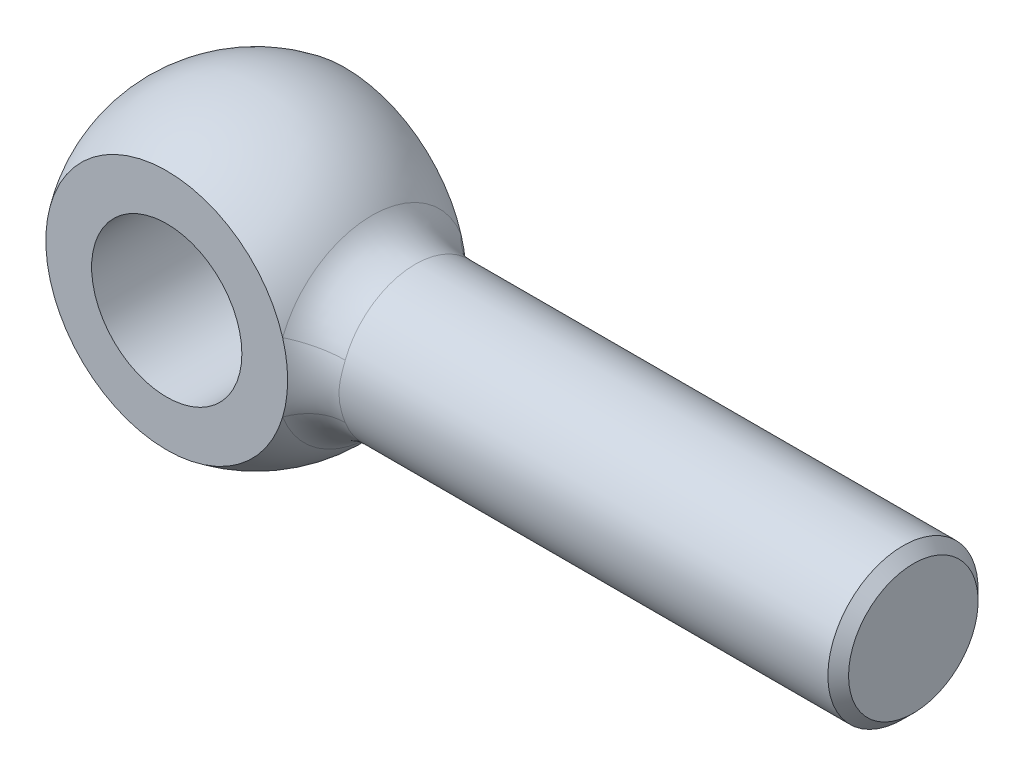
SolidWorks part; units mm, degrees
ref_plane "Plane1" through (0, 0, 0) normal (0, 0, 1) x (1, 0, 0)
ref_plane "Plane2" through (0, 0, 0) normal (0, 1, 0) x (1, 0, 0)
ref_plane "Plane3" through (0, 0, 0) normal (1, 0, 0) x (0, 0, -1)
sketch "BodySke" plane through (0, 0, 0) normal (0, 0, 1) x (1, 0, 0)
  line L0 (0, 0) -> (0, 8)
  line L3 (0, 8) -> (68.8985, 8)
  line L4 (70, 6.8985) -> (70, 0)
  line L5 (70, 0) -> (0, 0)
  line L6 (-31.75, 0) -> (127, 0) construction
  line L8 (70, 6.8985) -> (68.8985, 8)
  line L10 (70, -6.8985) -> (68.8985, -8) construction
  line L11 (2, 4.525) -> (2, -1.825) construction
  line L12 (0, 8) -> (0, -1.825) construction
  line L13 (32, 4.525) -> (32, -1.825) construction
revolve "Base-Revolve" add sketch "BodySke" angle 360 about L6
sketch "EyeSke" plane through (0, 0, 0) normal (1, 0, 0) x (0, 0, -1)
  line L0 (9.5, 0) -> (-9.5, 0)
  line L1 (9.5, 12.8744) -> (9.5, 0)
  line L2 (-9.5, 12.8744) -> (-9.5, 0)
  line L3 (9.5, 0) -> (-9.5, 0) construction
  arc A0 (9.5, 12.8744) -> (-9.5, 12.8744) centre (0, 0) ccw
  dimension "Head_dia" = 32
  dimension "Head_thickness" = 19
revolve "Eye" add sketch "EyeSke" angle 360 about L3
sketch "PupilSke" plane through (0, 0, 9.5) normal (0, 0, 1) x (1, 0, 0)
  circle A0 centre (0, 0) radius 8
  dimension "Diameter" = 16
extrude "Pupil" cut sketch "PupilSke" against normal through all
fillet "Fillet1" radius 6 1 edges at (13.8564, 0, 8)
sketch "ThdSchSke" plane through (0, 0, 0) normal (0, 0, 1) x (1, 0, 0)
  line L0 (34, -6.8985) -> (33.2287, -8)
  line L1 (34, -6.8985) -> (34.7713, -8)
  line L2 (34.7713, -8) -> (34.7713, -10)
  line L3 (-3.175, 0) -> (5.1513, 0) construction
  line L5 (34.7713, -10) -> (33.2287, -10)
  line L6 (33.2287, -10) -> (33.2287, -8)
revolve "ThreadSchematic" [suppressed] cut sketch "ThdSchSke" angle 360 about L3
pattern_linear "ThdSchPat" [suppressed]
equation "\"Thread_minor@ThreadCosmetic\"  =  \"Minor_dia@BodySke\""
equation "\"Thread_length@ThreadCosmetic\" = \"Thread_nom@BodySke\" - \"Advance@BodySke\""
equation "\"Thread_minor@ThdSchSke\" = \"Minor_dia@BodySke\""
equation "\"Diameter@ThdSchSke\" = \"Diameter@BodySke\""
equation "\"Overcut@ThdSchSke\" = \"Diameter@BodySke\" * 1.25"
equation "\"Start@ThdSchSke\" = \"Length@BodySke\" - \"Thread_length@ThreadCosmetic\""
equation "\"Num_threads@ThdSchPat\" = int( \"Thread_length@ThreadCosmetic\" / \"Advance@BodySke\" + 0.999 )  + 1"
equation "\"Advance@ThdSchPat\" = \"Thread_length@ThreadCosmetic\" /  (\"Num_threads@ThdSchPat\" - 1) 'relax it"
equation "\"Num_threads@ThdSchPat\" = \"Num_threads@ThdSchPat\" - sgn( \"Num_threads@ThdSchPat\" - 1) '---chamfered tips only---"
